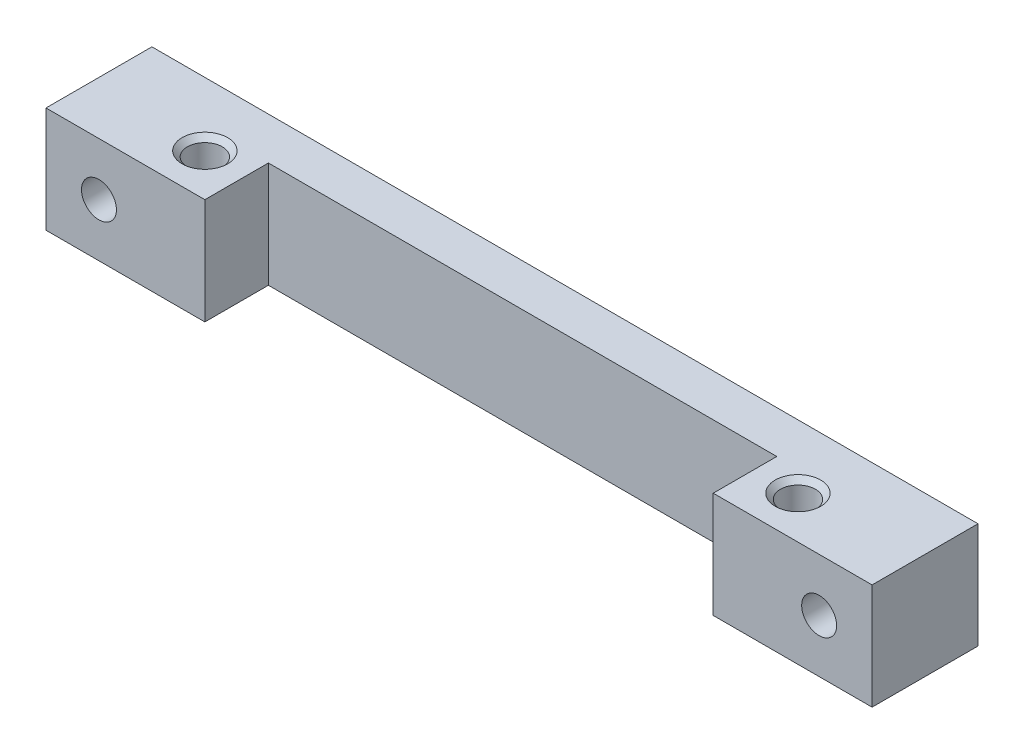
SolidWorks part; units mm, degrees
ref_plane "Спереди" through (0, 0, 0) normal (0, 0, 1) x (1, 0, 0)
ref_plane "Сверху" through (0, 0, 0) normal (0, 1, 0) x (1, 0, 0)
ref_plane "Справа" through (0, 0, 0) normal (1, 0, 0) x (0, 0, -1)
sketch "Эскиз1" plane through (0, 0, 0) normal (0, 1, 0) x (1, 0, 0)
  line L0 (0, 0) -> (0, -20.6773) construction
  line L1 (39, 0) -> (-39, 0)
  line L2 (-39, 0) -> (-39, -10)
  line L3 (-39, -10) -> (-24, -10)
  line L4 (-24, -10) -> (-24, -4)
  line L5 (-24, -4) -> (24, -4)
  line L6 (24, -10) -> (24, -4)
  line L7 (39, -10) -> (24, -10)
  line L8 (39, 0) -> (39, -10)
  point P9 (0, -4)
  dimension "D1" = 10
  dimension "D2" = 78
  dimension "D3" = 48
  dimension "D4" = 6
extrude "Бобышка-Вытянуть1" add sketch "Эскиз1" along normal blind 10
hole_wizard "Отверстие обработанное метчиком M41" positions "Эскиз3" profile "Эскиз2" tap size "M4" standard "DIN"
sketch "Эскиз3" plane through (0, 10, 0) normal (0, 1, 0) x (1, 0, 0)
  line L0 (0, 0) -> (0, -15.7298) construction
  line L2 (39, 0) -> (-39, 0) construction
  point P0 (-28, -6)
  point P2 (28, -6)
  dimension "D1" = 56
  dimension "D2" = 6
sketch "Эскиз2" plane through (-28, 10, 6) normal (1, 0, 0) x (0, 0, 1)
  line L0 (0, 0) -> (0, 10)
  line L1 (0, 10) -> (1.65, 10)
  line L2 (1.65, 10) -> (1.65, 0)
  line L5 (1.65, 0) -> (0, 0)
  line L11 (0, -6.35) -> (0, 107.95) construction
  dimension "Диаметр проходного сверла" = 3.3
  dimension "Глубина проходного сверла" = 10
hole_wizard "Отверстие обработанное метчиком M42" positions "Эскиз5" profile "Эскиз4" tap size "M4" standard "DIN"
sketch "Эскиз5" plane through (0, 0, 0) normal (0, 0, -1) x (-1, 0, 0)
  line L0 (0, 0) -> (0, 17.5113) construction
  line L1 (-39, 0) -> (39, 0) construction
  line L3 (-39, 10) -> (39, 10) construction
  point P0 (-34, 5)
  point P2 (34, 5)
  dimension "D1" = 5
  dimension "D2" = 68
sketch "Эскиз4" plane through (34, 5, 0) normal (1, 0, 0) x (0, 1, 0)
  line L0 (0, 0) -> (0, 10)
  line L1 (0, 10) -> (1.65, 10)
  line L2 (1.65, 10) -> (1.65, 0)
  line L5 (1.65, 0) -> (0, 0)
  line L11 (0, -6.35) -> (0, 107.95) construction
  dimension "Диаметр проходного сверла" = 3.3
  dimension "Глубина проходного сверла" = 10
chamfer "Фаска1" distance 0.5 angle 45 4 edges at (-35.65, 5, 0) (32.35, 5, 0) (28, 10, 7.65) (-28, 10, 7.65)
